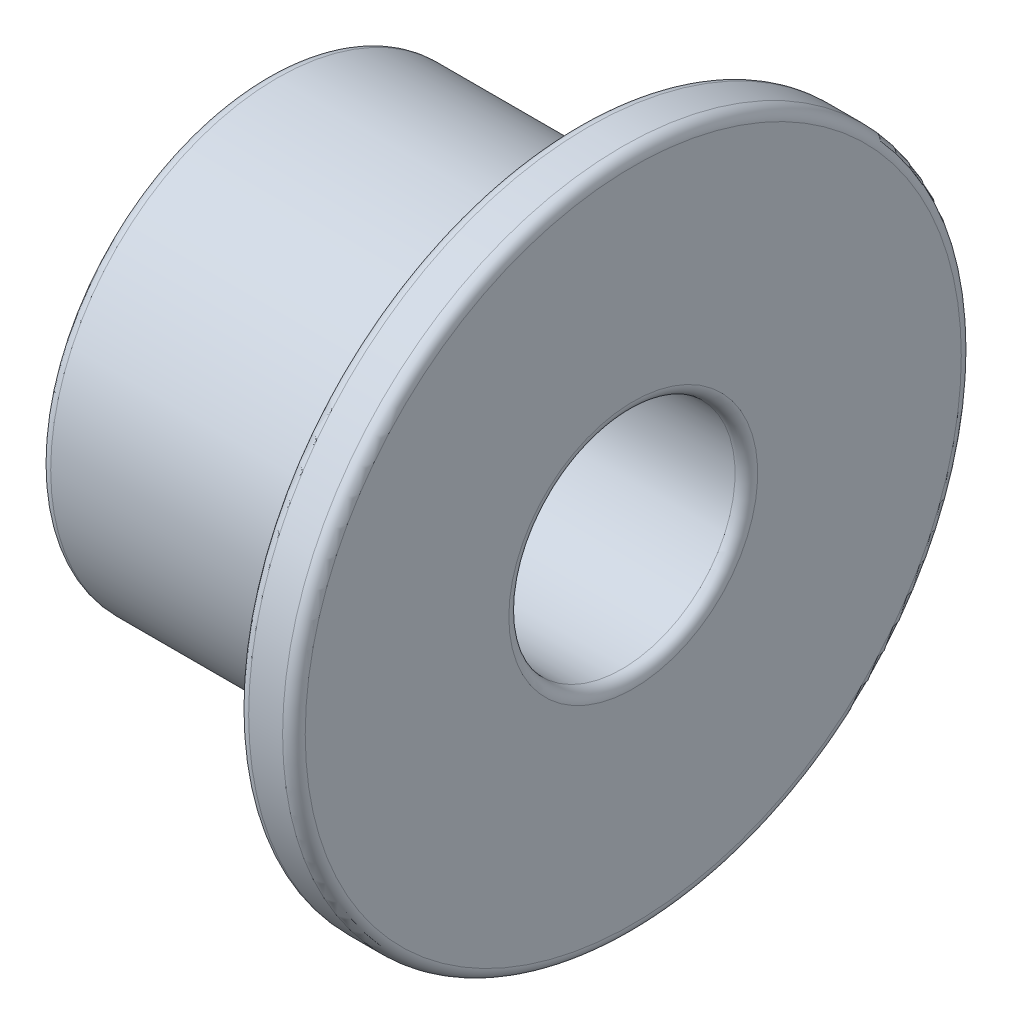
SolidWorks part; units mm, degrees
ref_plane "Face" through (0, 0, 0) normal (0, 0, 1) x (1, 0, 0)
ref_plane "Dessus" through (0, 0, 0) normal (0, 1, 0) x (1, 0, 0)
ref_plane "Droite" through (0, 0, 0) normal (1, 0, 0) x (0, 0, -1)
sketch "Esquisse1" plane through (0, 0, 0) normal (0, 0, 1) x (1, 0, 0)
  line L0 (0, 0) -> (31.6677, 0) construction
  line L1 (0, 2) -> (6.5, 2)
  line L2 (6.5, 2) -> (6.5, 6)
  line L3 (6.5, 6) -> (5.5, 6)
  line L4 (5.5, 6) -> (5.5, 4)
  line L5 (5.5, 4) -> (0, 4)
  line L6 (0, 4) -> (0, 2)
  dimension "D1" = 4
  dimension "D2" = 8
  dimension "D3" = 5.5
  dimension "D4" = 1
  dimension "D5" = 6
revolve "Révolution1" add sketch "Esquisse1" angle 360 about L0
fillet "Congé1" radius 0.2
